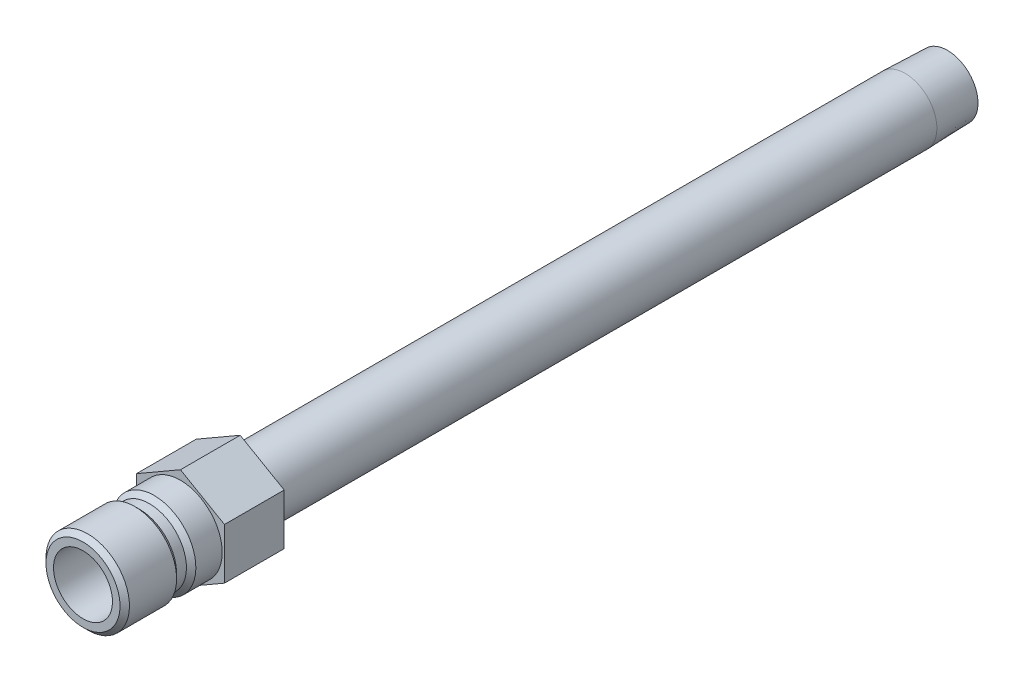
SolidWorks part; units mm, degrees
ref_plane "Front Plane" through (0, 0, 0) normal (0, 0, 1) x (1, 0, 0)
ref_plane "Top Plane" through (0, 0, 0) normal (0, 1, 0) x (1, 0, 0)
ref_plane "Right Plane" through (0, 0, 0) normal (1, 0, 0) x (0, 0, -1)
sketch "Sketch1" plane through (0, 0, 0) normal (1, 0, 0) x (0, 0, -1)
  line L0 (9.652, 0) -> (-18.923, 0) construction
  line L1 (-15.748, 4.7625) -> (-15.748, 5.9817)
  line L2 (-6.604, 5.9817) -> (-6.604, 0) construction
  line L3 (-14.986, 6.7437) -> (-7.366, 6.7437)
  line L4 (9.652, 5.1435) -> (9.652, 0) construction
  line L5 (-6.604, 5.9817) -> (-5.0165, 5.9817)
  line L6 (-4.2545, 6.7437) -> (9.652, 6.7437)
  line L7 (9.652, 6.7437) -> (9.652, 5.1435)
  line L8 (-6.604, 5.9817) -> (-7.366, 6.7437)
  line L9 (-5.0165, 5.9817) -> (-4.2545, 6.7437)
  line L10 (-15.748, 5.9817) -> (-14.986, 6.7437)
  line L11 (-15.748, 4.7625) -> (-3.556, 4.7625)
  line L12 (9.652, 5.1435) -> (117.094, 5.1435)
  line L13 (117.094, 5.1435) -> (123.952, 4.9292)
  line L14 (123.952, 4.9292) -> (123.952, 3.4163)
  line L15 (0, 0) -> (0, 6.7437) construction
  line L16 (9.652, 6.731) -> (9.652, 0) construction
  line L17 (-3.556, 4.7625) -> (-2.8402, 3.4163)
  line L19 (-2.8402, 3.4163) -> (123.952, 3.4163)
  dimension "D2" = 1.5875
  dimension "D3" = 0.762
  dimension "D4" = 45
  dimension "D5" = 9.144
  dimension "D6" = 45
  dimension "D7" = 1.79
  dimension "D8" = 6.858
  dimension "D9" = 139.7
  dimension "D10" = 3.175
  dimension "D11" = 9.525
  dimension "D12" = 10.287
  dimension "D13" = 25.4
  dimension "D14" = 13.4874
  dimension "D15" = 6.8326
  dimension "D16" = 12.192
  dimension "D17" = 9.652
  dimension "D18" = 118
revolve "Revolve1" add sketch "Sketch1" angle 360 about L0
sketch "Sketch2" plane through (0, 0, 0) normal (0, 0, 1) x (1, 0, 0)
  line L1 (-7.112, 4.1061) -> (-7.112, -4.1061)
  line L2 (-7.112, -4.1061) -> (0, -8.2122)
  line L3 (0, -8.2122) -> (7.112, -4.1061)
  line L4 (7.112, -4.1061) -> (7.112, 4.1061)
  line L5 (7.112, 4.1061) -> (0, 8.2122)
  line L6 (0, 8.2122) -> (-7.112, 4.1061)
  circle A0 centre (0, 0) radius 7.112 construction
  circle A1 centre (0, 0) radius 4.7625 construction
  circle A2 centre (0, 0) radius 4.7625
  dimension "D1" = 14.224
extrude "Boss-Extrude1" add sketch "Sketch2" against normal up to vertex (9.652 mm away)
